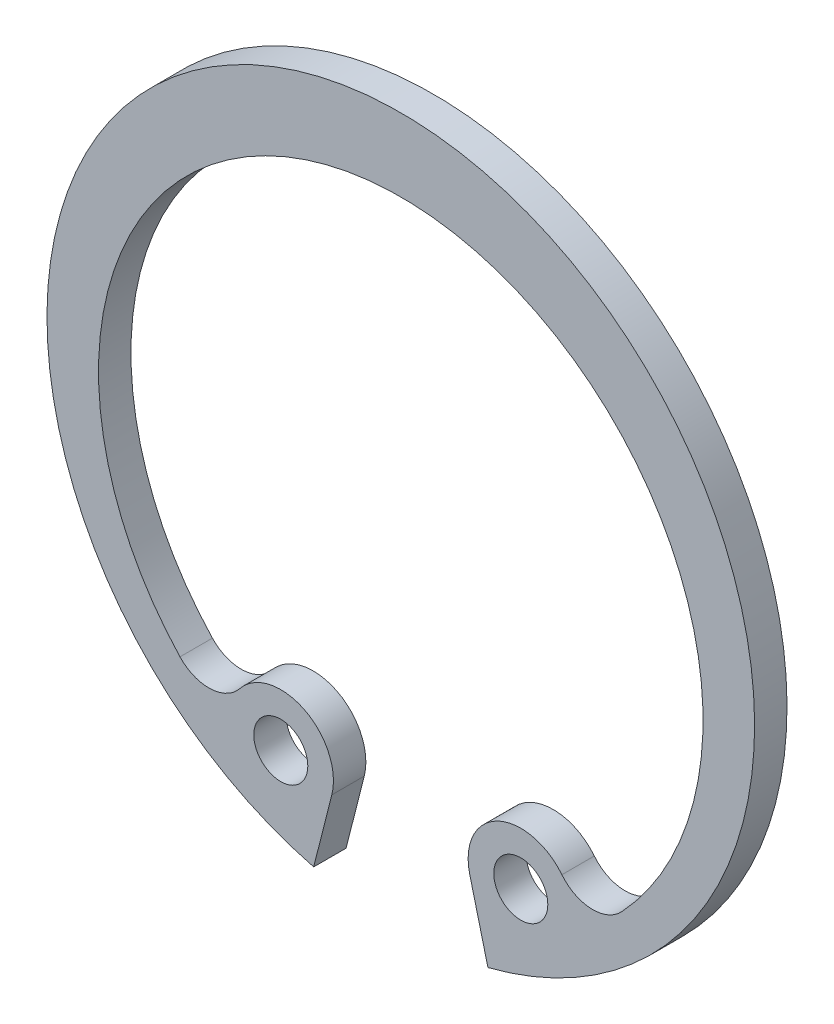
SolidWorks part; units mm, degrees
ref_plane "Plane1" through (0, 0, 0) normal (0, 0, 1) x (1, 0, 0)
ref_plane "Plane2" through (0, 0, 0) normal (0, 1, 0) x (1, 0, 0)
ref_plane "Plane3" through (0, 0, 0) normal (1, 0, 0) x (0, 0, -1)
sketch "Clipboard" plane through (0, 0, 0) normal (0, 0, 1) x (1, 0, 0)
  line L0 (0, 0) -> (2.7, 0)
  line L1 (0, 0) -> (0, 1.35)
  line L2 (0, 0) -> (0, -4.5)
  circle A0 centre (0, 0) radius 1
  circle A1 centre (0, 0) radius 12.5
  dimension "HoleDia" = 2
  dimension "BoreDia" = 25
  dimension "LargeSection" = 2.7
  dimension "SmallSection" = 1.35
  dimension "LugSection" = 4.5
sketch "BodySke" plane through (0, 0, 0) normal (0, 0, 1) x (1, 0, 0)
  line L0 (-1.5431, 0) -> (1.5431, 0) construction
  line L1 (0, 0) -> (0, 10.4) construction
  line L2 (3.2259, -12.6966) -> (2.5532, -10.0489)
  line L3 (-3.2259, -12.6966) -> (-2.5532, -10.0489)
  line L4 (0, 0) -> (9.0513, -9.4701) construction
  line L5 (0, 0) -> (-9.0513, -9.4701) construction
  line L6 (-4.1969, -8.5996) -> (-4.6894, -10.538) construction
  line L7 (4.2583, -8.8413) -> (4.628, -10.2962) construction
  arc A0 (-2.5532, -10.0489) -> (-5.9651, -8.3498) centre (-4.4431, -9.5688) ccw
  arc A1 (5.9651, -8.3498) -> (2.5532, -10.0489) centre (4.4431, -9.5688) ccw
  arc A2 (8.1185, -8.4942) -> (-8.1185, -8.4942) centre (0, -0.7913) ccw construction
  arc A3 (3.2259, -12.6966) -> (-3.2259, -12.6966) centre (0, 0) ccw
  circle A4 centre (4.4431, -9.5688) radius 1
  circle A5 centre (-4.4431, -9.5688) radius 1
  circle A6 centre (4.4431, -9.5688) radius 1.95 construction
  arc A7 (8.175, -8.4343) -> (-8.175, -8.4343) centre (0, -0.7913) ccw
  arc A8 (-4.4431, -9.5688) -> (4.4431, -9.5688) centre (0, 0) ccw construction
  arc A9 (-8.175, -8.4343) -> (-5.9651, -8.3498) centre (-7.1067, -7.4355) ccw
  arc A10 (5.9651, -8.3498) -> (8.175, -8.4343) centre (7.1067, -7.4355) ccw
  dimension "GrooveDia" = 26.2
  dimension "TipRad" = 1.95
  dimension "HoleOffsetRad" = 10.55
  dimension "HoleDia" = 2
  dimension "FilletRad" = 1.4625
  dimension "LargeRad" = 10.4
  dimension "SmallRad" = 11.75
  dimension "SmallAngle" = 87.409
  dimension "GapAngle" = 28.511
extrude "Body" add sketch "BodySke" against normal blind 1.2
sketch "ModLugSke" plane through (0, 0, 0) normal (0, 0, 1) x (1, 0, 0)
  line L0 (3.2259, -12.6966) -> (2.1422, -8.4315)
  line L1 (-3.2259, -12.6966) -> (-2.1422, -8.4315)
  line L2 (7.0959, -4.8588) -> (10.8089, -7.4011) construction
  line L3 (-7.0959, -4.8588) -> (-10.8089, -7.4011) construction
  line L4 (-3.2259, -12.6966) -> (-2.5532, -10.0489) construction
  line L5 (2.5532, -10.0489) -> (3.2259, -12.6966) construction
  line L6 (0, 0) -> (0, -18.0732) construction
  line L7 (9.5814, -6.5606) -> (10.8089, -7.4011)
  line L8 (-10.8089, -7.4011) -> (-9.5814, -6.5606)
  arc A0 (3.2259, -12.6966) -> (10.8089, -7.4011) centre (0, 0) ccw
  arc A1 (-4.9183, -7.0548) -> (-2.2134, -8.3103) centre (0, 0) ccw
  arc A2 (3.2259, -12.6966) -> (-3.2259, -12.6966) centre (0, 0) ccw construction
  arc A3 (5.9651, -8.3498) -> (2.5532, -10.0489) centre (4.4431, -9.5688) ccw construction
  arc A4 (-4.9183, -7.0548) -> (-5.0436, -7.0637) centre (-4.9754, -7.1369) ccw
  arc A5 (-9.5814, -6.5606) -> (-5.0436, -7.0637) centre (-7.0959, -4.8588) ccw
  arc A6 (8.175, -8.4343) -> (-8.175, -8.4343) centre (0, -0.7913) ccw construction
  arc A7 (5.0436, -7.0637) -> (9.5814, -6.5606) centre (7.0959, -4.8588) ccw
  arc A8 (2.2134, -8.3103) -> (4.9183, -7.0548) centre (0, 0) ccw
  arc A9 (-10.8089, -7.4011) -> (-3.2259, -12.6966) centre (0, 0) ccw
  circle A10 centre (-4.4431, -9.5688) radius 1
  circle A11 centre (-4.4431, -9.5688) radius 1 construction
  circle A12 centre (4.4431, -9.5688) radius 1
  circle A13 centre (4.4431, -9.5688) radius 1 construction
  arc A14 (-2.2134, -8.3103) -> (-2.1422, -8.4315) centre (-2.2392, -8.4069) cw
  arc A15 (2.2134, -8.3103) -> (2.1422, -8.4315) centre (2.2392, -8.4069) ccw
  arc A16 (4.9183, -7.0548) -> (5.0436, -7.0637) centre (4.9754, -7.1369) cw
  point P43 (2.1178, -8.3352)
  dimension "D1" = 0.1
  dimension "LugAng" = 69.764
extrude "ModLug" [suppressed] add sketch "ModLugSke" against normal through all
sketch "UnlSke" [suppressed] plane through (0, 0, 0) normal (0, 0, 1) x (1, 0, 0)
  line L0 (2.1178, -8.3352) -> (3.2259, -12.6966)
  line L1 (-2.1178, -8.3352) -> (-3.2259, -12.6966)
  line L2 (-3.2259, -12.6966) -> (-2.1422, -8.4315) construction
  line L3 (2.1422, -8.4315) -> (3.2259, -12.6966) construction
  arc A0 (2.1178, -8.3352) -> (-2.1178, -8.3352) centre (0, 0) ccw
  arc A1 (3.2259, -12.6966) -> (-3.2259, -12.6966) centre (0, 0) ccw
  arc A2 (3.2259, -12.6966) -> (-3.2259, -12.6966) centre (0, 0) ccw construction
  circle A4 centre (-4.4431, -9.5688) radius 1
  circle A5 centre (4.4431, -9.5688) radius 1
  circle A6 centre (4.4431, -9.5688) radius 1 construction
  circle A7 centre (-4.4431, -9.5688) radius 1 construction
  arc A8 (2.2134, -8.3103) -> (4.9183, -7.0548) centre (0, 0) ccw construction
extrude "Unlug" [suppressed] add sketch "UnlSke" against normal through all
equation "' \"BoreDia@Clipboard\" = 8"
equation "' \"Thickness@Body\" = 0.8"
equation "' \"GrooveDia@BodySke\" = 8.4"
equation "' \"LugSection@Clipboard\" = 2.4"
equation "' \"LargeSection@Clipboard\" = 1.1"
equation "' \"HoleDia@Clipboard\" = 1"
equation "' \"BoreDia@Clipboard\" = 25"
equation "' \"Thickness@Body\" = 1.2"
equation "' \"GrooveDia@BodySke\" = 26.2"
equation "' \"LugSection@Clipboard\" = 4.5"
equation "' \"LargeSection@Clipboard\" = 2.7"
equation "' \"HoleDia@Clipboard\" = 2"
equation "\"SmallSection@Clipboard\" = \"LargeSection@Clipboard\" * 0.5"
equation "\"TipRad@BodySke\" = (\"LugSection@Clipboard\" - (\"GrooveDia@BodySke\" / 2  -  \"BoreDia@Clipboard\" / 2 ) ) / 2"
equation "\"HoleOffsetRad@BodySke\" = (\"GrooveDia@BodySke\" / 2) - \"LugSection@Clipboard\"  + \"TipRad@BodySke\""
equation "\"LargeRad@BodySke\" =  \"GrooveDia@BodySke\" / 2 -  \"LargeSection@Clipboard\""
equation "\"SmallRad@BodySke\" =  \"GrooveDia@BodySke\" / 2 -  \"SmallSection@Clipboard\""
equation "\"HoleDia@BodySke\" =  \"HoleDia@Clipboard\""
equation "\"FilletRad@BodySke\" = \"TipRad@BodySke\" * 0.75"
equation "\"GapAngle@BodySke\" = 360 - 0.965 * 360 * ( \"BoreDia@Clipboard\" /  \"GrooveDia@BodySke\")"
equation "\"LugAng@ModLugSke\" = \"GapAngle@BodySke\"  + 2 * 360 * (\"LugSection@Clipboard\" / (\"BoreDia@Clipboard\" * 3.1416))"
